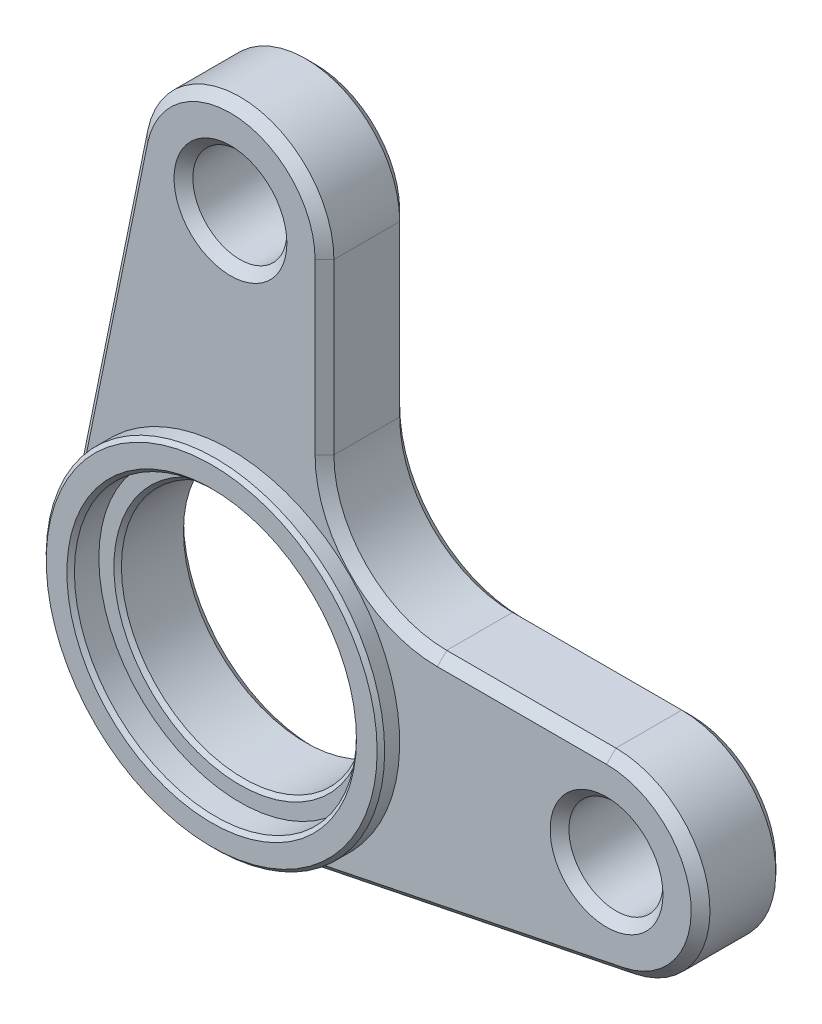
SolidWorks part; units mm, degrees
ref_plane "前视" through (0, 0, 0) normal (0, 0, 1) x (1, 0, 0)
ref_plane "上视" through (0, 0, 0) normal (0, 1, 0) x (1, 0, 0)
ref_plane "右视" through (0, 0, 0) normal (1, 0, 0) x (0, 0, -1)
sketch "草图1" plane through (0, 0, 0) normal (0, 0, 1) x (1, 0, 0)
  line L0 (0, 0) -> (0, 20) construction
  line L1 (0, 0) -> (20, 0) construction
  line L2 (-4.899, 21) -> (-8.8182, 1.8)
  line L3 (1.8, -8.8182) -> (21, -4.899)
  line L4 (5, 20) -> (5, 11)
  line L5 (11, 5) -> (20, 5)
  circle A0 centre (0, 0) radius 6.5
  arc A1 (-8.8182, 1.8) -> (1.8, -8.8182) centre (0, 0) ccw
  circle A2 centre (0, 20) radius 2.5
  arc A3 (5, 20) -> (-4.899, 21) centre (0, 20) ccw
  circle A4 centre (20, 0) radius 2.5
  arc A5 (21, -4.899) -> (20, 5) centre (20, 0) ccw
  arc A6 (5, 11) -> (11, 5) centre (11, 11) ccw
  dimension "D1" = 20
  dimension "D2" = 20
  dimension "D3" = 5
  dimension "D4" = 5
  dimension "D5" = 13
  dimension "D6" = 18
  dimension "D7" = 10
  dimension "D8" = 10
  dimension "D9" = 6
extrude "凸台-拉伸1" add sketch "草图1" along normal blind 4.5
sketch "草图2" plane through (0, 0, 4.5) normal (0, 0, 1) x (1, 0, 0)
  circle A0 centre (0, 0) radius 9
  arc A1 (-8.8182, 1.8) -> (1.8, -8.8182) centre (0, 0) ccw construction
  circle A2 centre (0, 0) radius 6.5 construction
  circle A3 centre (0, 0) radius 6.5
extrude "凸台-拉伸2" add sketch "草图2" along normal blind 1
sketch "草图3" plane through (0, 0, 5.5) normal (0, 0, 1) x (1, 0, 0)
  circle A0 centre (0, 0) radius 7.5
  dimension "D1" = 15
extrude "切除-拉伸1" cut sketch "草图3" against normal blind 1.5
chamfer "倒角1" distance 0.5 angle 45 20 edges at (22.5, 0, 0) (2.5, 20, 0) (6.5, 0, 0) (15.5, 5, 0) (6.7574, 6.7574, 0) (5, 15.5, 0) (0.5025, 24.9747, 0) (-6.8586, 11.4, 0) (-6.364, -6.364, 0) (11.4, -6.8586, 0) (24.9747, 0.5025, 0) (11.4, -6.8586, 4.5) (24.9747, 0.5025, 4.5) (15.5, 5, 4.5) (-6.8586, 11.4, 4.5) (6.7574, 6.7574, 4.5) (0.5025, 24.9747, 4.5) (5, 15.5, 4.5) (22.5, 0, 4.5) (2.5, 20, 4.5)
chamfer "倒角2" distance 0.2 angle 45 3 edges at (9, 0, 5.5) (7.5, 0, 5.5) (6.5, 0, 4)
